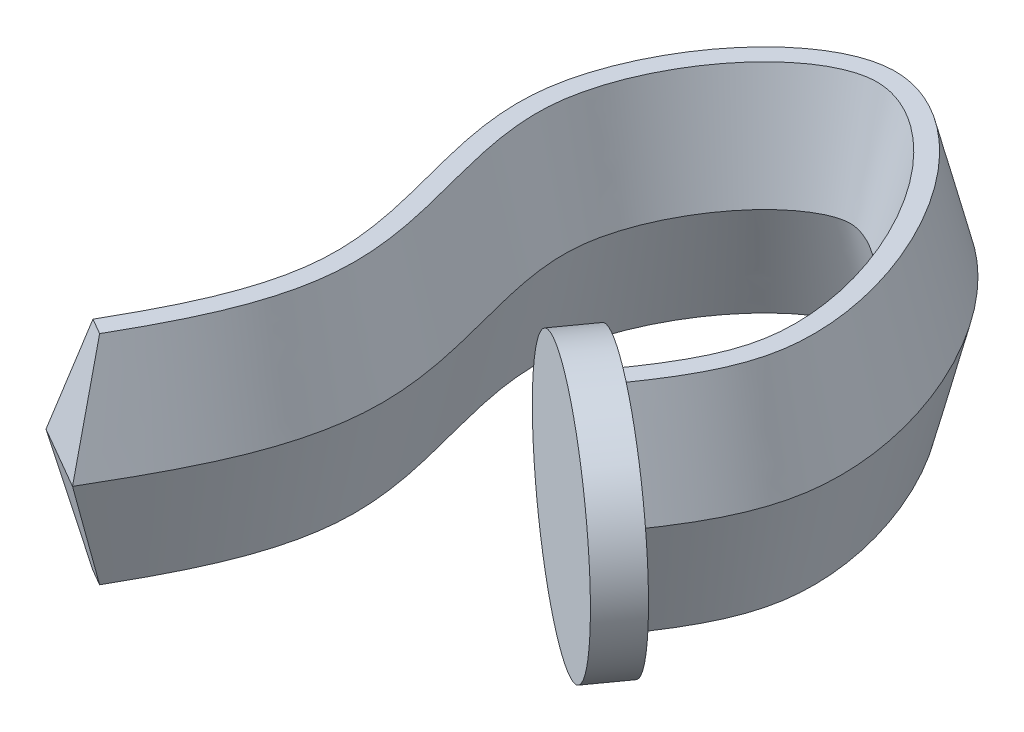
SolidWorks part; units mm, degrees
ref_plane "Front Plane" through (0, 0, 0) normal (0, 0, 1) x (1, 0, 0)
ref_plane "Top Plane" through (0, 0, 0) normal (0, 1, 0) x (1, 0, 0)
ref_plane "Right Plane" through (0, 0, 0) normal (1, 0, 0) x (0, 0, -1)
sketch "Sketch4" plane through (0, 0, 0) normal (0, 1, 0) x (1, 0, 0)
  spline S0 degree 3 poles (0, 0) (4.7855, 8.2826) (15.8548, 27.4408) (-4.0593, 59.936) (34.4236, 110.6942) (69.5685, 52.2376) (54.4286, 31.1642) (50, 25) knots 0 0 0 0 0.151459 0.350334 0.569999 0.87422 1 1 1 1
  dimension "D1" = 25
  dimension "D2" = 10
  dimension "D3" = 60
  dimension "D4" = 5
  dimension "D5" = 30
  dimension "D6" = 90
  dimension "D7" = 60
  dimension "D8" = 50
  dimension "D9" = 25
  dimension "D10" = 45
extrude "Extrude-Thin2" add sketch "Sketch4" along normal mid plane 30 draft 14 thin
ref_plane "Plane2" through (50, 0, -25) normal (-0.5835, 0, 0.8121) x (0.8121, 0, 0.5835)
sketch "Sketch5" plane through (50, 0, -25) normal (-0.5835, 0, 0.8121) x (0.8121, 0, 0.5835)
  line L0 (0, 0) -> (-10, 0) construction
  circle A0 centre (-5, 0) radius 17.5
  dimension "D1" = 35
extrude "Extrude4" add sketch "Sketch5" along normal blind 2 and the other way up to vertex
ref_plane "Plane3" through (0, 0, 0) normal (0.5003, 0, -0.8659) x (-0.8659, 0, -0.5003)
